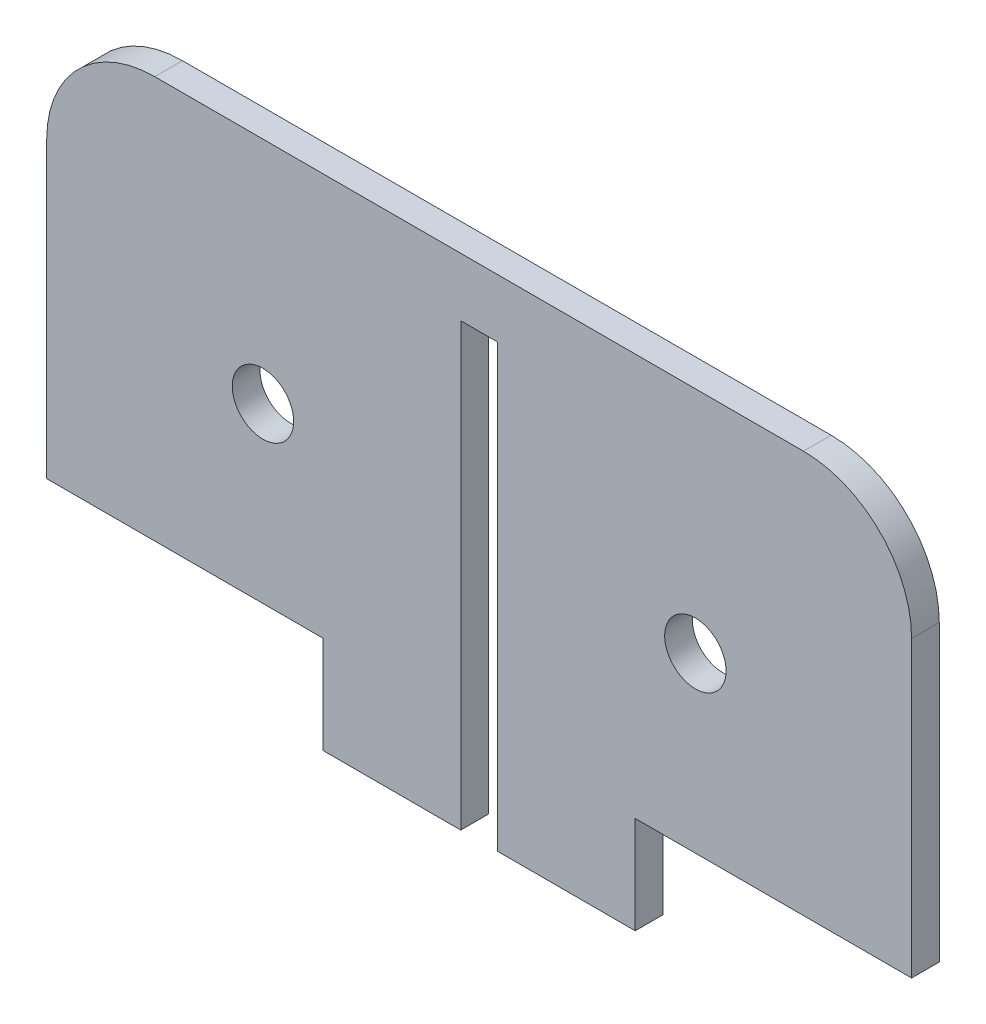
SolidWorks part; units mm, degrees
ref_plane "Front Plane" through (0, 0, 0) normal (0, 0, 1) x (1, 0, 0)
ref_plane "Top Plane" through (0, 0, 0) normal (0, 1, 0) x (1, 0, 0)
ref_plane "Right Plane" through (0, 0, 0) normal (1, 0, 0) x (0, 0, -1)
sketch "Sketch1" plane through (0, 0, 0) normal (0, 0, 1) x (1, 0, 0)
  line L0 (0, 22.5) -> (0, 90.5)
  line L1 (25, 115.5) -> (175, 115.5)
  line L2 (200, 90.5) -> (200, 22.5)
  line L3 (200, 22.5) -> (136.0937, 22.5)
  line L4 (136.0937, 22.5) -> (136.0937, 0)
  line L5 (136.0937, 0) -> (104.25, 0)
  line L6 (104.25, 0) -> (104.25, 102)
  line L7 (104.25, 102) -> (95.75, 102)
  line L8 (95.75, 102) -> (95.75, 0)
  line L9 (95.75, 0) -> (63.9063, 0)
  line L10 (63.9063, 0) -> (63.9063, 22.5)
  line L11 (63.9063, 22.5) -> (0, 22.5)
  line L12 (100, 102) -> (100, -11.1984) construction
  arc A0 (25, 115.5) -> (0, 90.5) centre (25, 90.5) ccw
  arc A1 (200, 90.5) -> (175, 115.5) centre (175, 90.5) ccw
  circle A2 centre (50, 62.5) radius 7.1
  circle A3 centre (150, 62.5) radius 7.1
  dimension "D1" = 8.5
  dimension "D2" = 102
  dimension "D3" = 93
  dimension "D4" = 200
  dimension "D5" = 63.9063
sheet metal parameters "Sheet-Metal1" thickness 6.4 parameters "D1"=0.7366
base flange "Base-Flange1" sketch "Sketch1" thickness 6.4 reverse thickness direction no parameters "D1"=0.7366
flat pattern "Flat-Pattern1"
sketch "Bend-Lines1" plane through (0, 0, 0) normal (0, 1, 0) x (-1, 0, 0)
